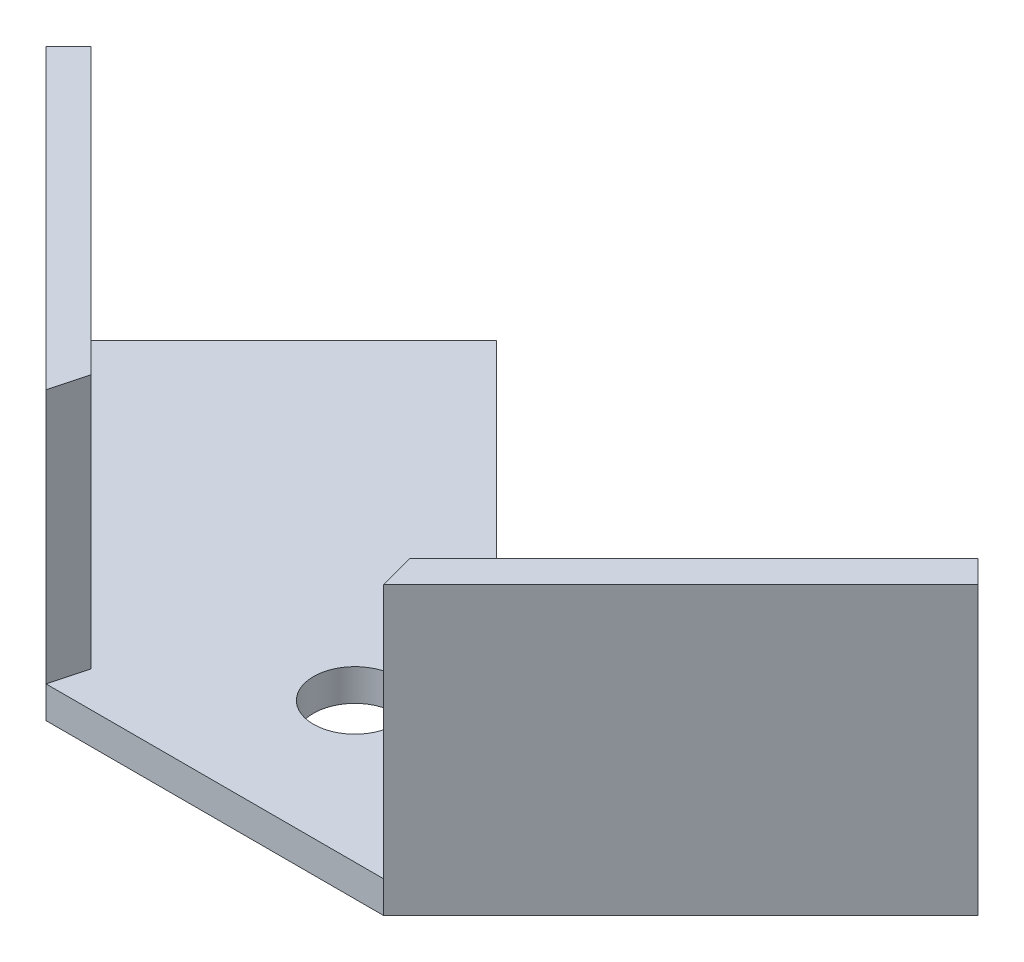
SolidWorks part; units mm, degrees
ref_plane "Front Plane" through (0, 0, 0) normal (0, 0, 1) x (1, 0, 0)
ref_plane "Top Plane" through (0, 0, 0) normal (0, 1, 0) x (1, 0, 0)
ref_plane "Right Plane" through (0, 0, 0) normal (1, 0, 0) x (0, 0, -1)
sketch "Sketch1" plane through (0, 0, 0) normal (0, 1, 0) x (1, 0, 0)
  line L0 (-1711.2425, 0) -> (83850.8807, 0) construction
  line L1 (0, -1711.2425) -> (0, 83850.8807) construction
  line L2 (26.5, 0) -> (-26.5, 0)
  line L3 (-26.5, 0) -> (-73.169, 46.669)
  line L4 (-37.8137, 82.0244) -> (0, 44.2107)
  line L5 (-73.169, 46.669) -> (-37.8137, 82.0244)
  line L6 (73.169, 46.669) -> (37.8137, 82.0244)
  line L7 (37.8137, 82.0244) -> (0, 44.2107)
  line L8 (26.5, 0) -> (73.169, 46.669)
  circle A0 centre (0, 22) radius 6.5
  point P13 (0, 0)
  dimension "D1" = 13
  dimension "D2" = 53
  dimension "D3" = 135
  dimension "D4" = 66
  dimension "D5" = 50
  dimension "D6" = 22
extrude "Boss-Extrude1" add sketch "Sketch1" along normal blind 5
sketch "Sketch2" plane through (0, 5, 0) normal (0, 1, 0) x (1, 0, 0)
  line L0 (-73.169, 46.669) -> (-26.5, 0)
  line L1 (-26.5, 0) -> (-25.0057, 5.5768)
  line L2 (-25.0057, 5.5768) -> (-69.6335, 50.2046)
  line L3 (-37.8137, 82.0244) -> (-73.169, 46.669) construction
  line L4 (-69.6335, 50.2046) -> (-73.169, 46.669)
  line L5 (0, -1000) -> (0, 49000) construction
  line L6 (69.6335, 50.2046) -> (73.169, 46.669)
  line L7 (25.0057, 5.5768) -> (69.6335, 50.2046)
  line L8 (26.5, 0) -> (25.0057, 5.5768)
  line L9 (73.169, 46.669) -> (26.5, 0)
  dimension "D1" = 5
  dimension "D2" = 60
extrude "Boss-Extrude2" add sketch "Sketch2" along normal blind 40
